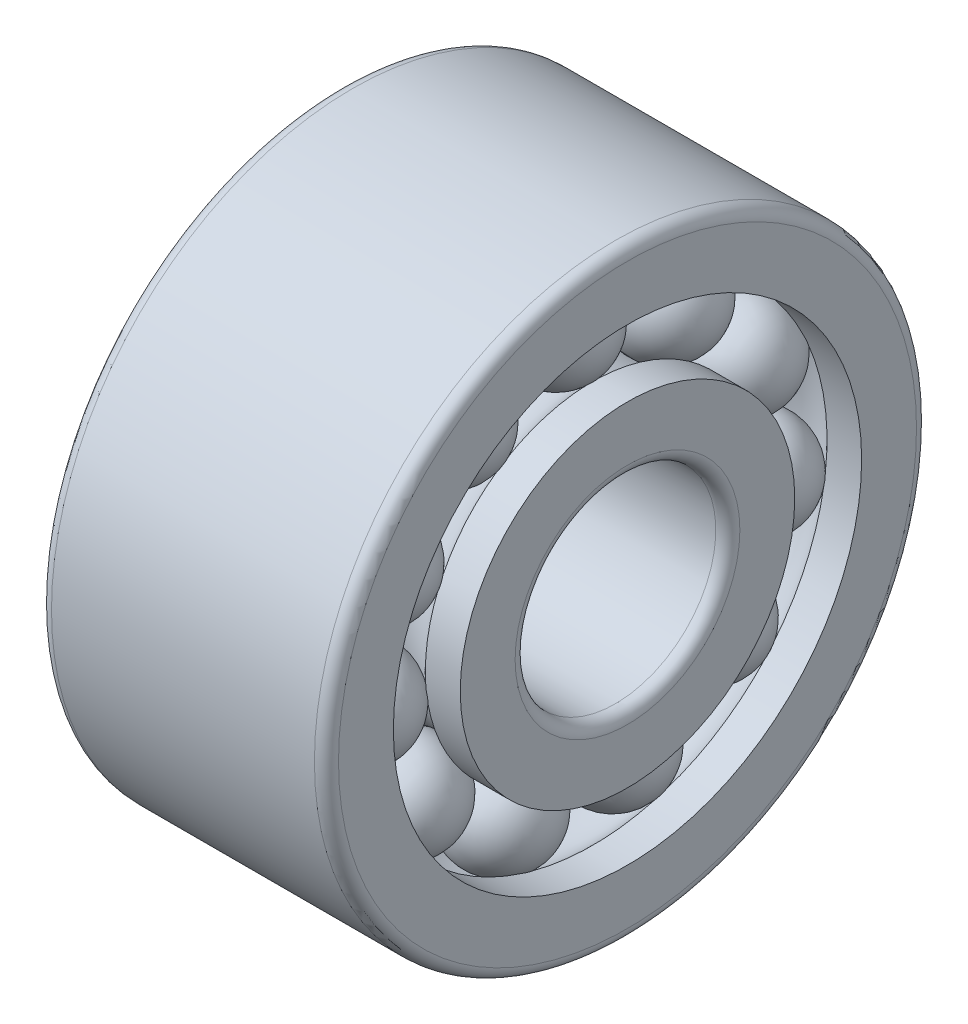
SolidWorks part; units mm, degrees
ref_plane "Front" through (0, 0, 0) normal (0, 0, 1) x (1, 0, 0)
ref_plane "Top" through (0, 0, 0) normal (0, 1, 0) x (1, 0, 0)
ref_plane "Right" through (0, 0, 0) normal (1, 0, 0) x (0, 0, -1)
other "Configuration Table"
sketch "Sketch1" plane through (0, 0, 0) normal (0, 0, 1) x (1, 0, 0)
  line L0 (-7.15, 5) -> (7.15, 5)
  line L1 (7.15, 5) -> (7.15, 8.3333)
  line L2 (7.15, 8.3333) -> (5.4115, 8.3333)
  line L3 (-7.15, 8.3333) -> (-7.15, 5)
  line L4 (-17.2026, 0) -> (19.471, 0) construction
  line L5 (-8.8622, 10) -> (12.5675, 10) construction
  line L6 (-5.4115, 8.3333) -> (-7.15, 8.3333)
  line L7 (1.7385, 8.3333) -> (-1.7385, 8.3333) construction
  arc A0 (-5.4115, 8.3333) -> (-1.7385, 8.3333) centre (-3.575, 10) ccw
  arc A1 (1.7385, 8.3333) -> (5.4115, 8.3333) centre (3.575, 10) ccw
  arc A2 (-1.7385, 8.3333) -> (1.7385, 8.3333) centre (0, 12.9787) ccw
revolve "Revolve1" add sketch "Sketch1" angle 360 about L4
sketch "Sketch2" plane through (0, 0, 0) normal (0, 0, 1) x (1, 0, 0)
  line L0 (-10.0989, 0) -> (10.8887, 0) construction
  line L2 (-10.0989, 10) -> (10.0671, 10) construction
  line L3 (-6.075, 10) -> (-1.075, 10)
  line L4 (1.075, 10) -> (6.075, 10)
  arc A0 (-6.075, 10) -> (-1.075, 10) centre (-3.575, 10) ccw
  arc A1 (1.075, 10) -> (6.075, 10) centre (3.575, 10) ccw
revolve "Revolve2" add sketch "Sketch2" angle 360 about L2
sketch "Sketch3" plane through (0, 0, 0) normal (0, 0, 1) x (1, 0, 0)
  line L0 (-7.15, 11.6667) -> (-7.15, 15)
  line L1 (-7.15, 15) -> (7.15, 15)
  line L2 (7.15, 15) -> (7.15, 11.6667)
  line L3 (7.15, 11.6667) -> (5.425, 11.6667)
  line L4 (-10.3666, 0) -> (11.6147, 0) construction
  line L6 (-9.6777, 10) -> (8.7392, 10) construction
  line L7 (1.725, 11.6667) -> (-1.725, 11.6667) construction
  line L8 (-5.425, 11.6667) -> (-7.15, 11.6667)
  arc A0 (-1.725, 11.6667) -> (-5.425, 11.6667) centre (-3.575, 10) ccw
  arc A1 (5.425, 11.6667) -> (1.725, 11.6667) centre (3.575, 10) ccw
  arc A2 (-1.725, 11.6667) -> (1.725, 11.6667) centre (0, 7.0163) cw
  arc A3 (-1.7385, 8.3333) -> (1.7385, 8.3333) centre (0, 12.9787) ccw construction
revolve "Revolve3" add sketch "Sketch3" angle 360 about L4
pattern_circular "Circular-Pattern1" count 11 over 360 about axis through (0, 0, 0) along (1, 0, 0) of "Revolve2"
fillet "Fillet1" radius 0.6 4 edges at (-7.15, 0, 5) (-7.15, 0, 15) (7.15, 0, 5) (7.15, 0, 15)
equation "\"D5@Sketch1\" = ( \"d@Sketch1\" + \"DD@Sketch3\"  )  / 4"
equation "\"D4@Sketch1\" = \"B@Sketch1\" / 2"
equation "\"D2@Sketch1\" = \"d@Sketch1\" + ( \"DD@Sketch3\" - \"d@Sketch1\" )  / 3"
equation "\"D3@Sketch1\" =  ( \"DD@Sketch3\" - \"d@Sketch1\" )  / 8 - 0.02"
equation "\"D1@Sketch1\" = \"B@Sketch1\" / 2"
equation "\"D6@Sketch1\" = \"D1@Sketch1\" / 2"
equation "\"D1@Sketch2\" = ( \"d@Sketch1\" + \"DD@Sketch3\"  )  / 4"
equation "\"D2@Sketch2\" = \"B@Sketch1\" / 2"
equation "\"D3@Sketch2\" = \"D2@Sketch2\" / 2"
equation "\"D4@Sketch2\" =  ( \"DD@Sketch3\" - \"d@Sketch1\" )  / 4"
equation "\"D1@Sketch3\" = ( \"d@Sketch1\" + \"DD@Sketch3\"  )  / 4"
equation "\"B@Sketch3\" = \"B@Sketch1\""
equation "\"D4@Sketch3\" = \"B@Sketch3\" / 2"
equation "\"D2@Sketch3\" = \"DD@Sketch3\" - ( \"DD@Sketch3\" - \"d@Sketch1\"  )  / 3"
equation "\"D6@Sketch3\" =  ( \"DD@Sketch3\" - \"d@Sketch1\" )  / 4 - 0.02"
equation "\"D3@Sketch3\" = \"B@Sketch1\" / 2"
equation "\"D5@Sketch3\" = \"D3@Sketch3\" / 2"
equation "\"m@Circular-Pattern1\" = int( 3.14159265 / atn((\"D4@Sketch2\"/2) / sqr(( \"d@Sketch1\" + \"DD@Sketch3\"  )  / 4 * ( \"d@Sketch1\" + \"DD@Sketch3\"  )  / 4 - (\"D4@Sketch2\"/2) *  (\"D4@Sketch2\"/2))))-1"
equation "\"D7@Sketch1\" = \"D3@Sketch1\" * 2"
